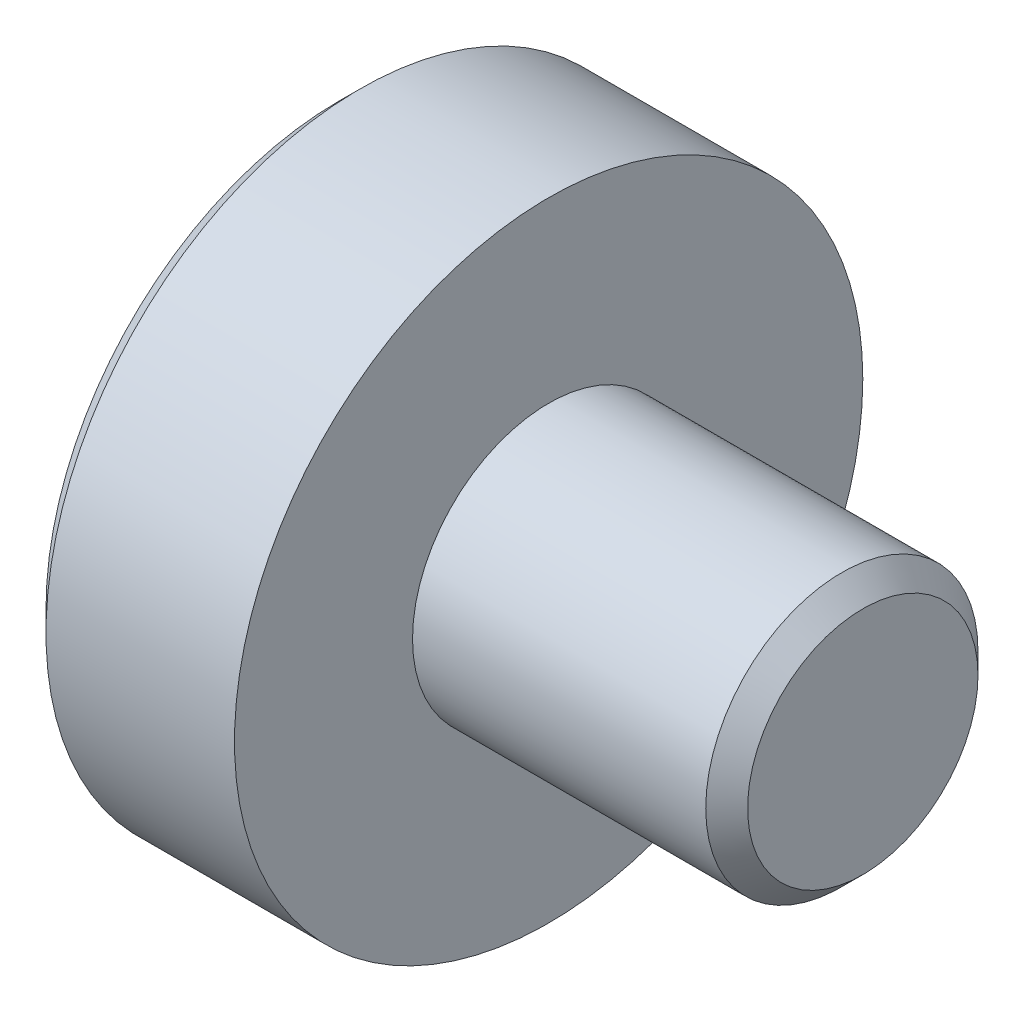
SolidWorks part; units mm, degrees
ref_plane "Front Plane" through (0, 0, 0) normal (0, 0, 1) x (1, 0, 0)
ref_plane "Top Plane" through (0, 0, 0) normal (0, 1, 0) x (1, 0, 0)
ref_plane "Right Plane" through (0, 0, 0) normal (1, 0, 0) x (0, 0, -1)
sketch "Sketch1" plane through (0, 0, 0) normal (1, 0, 0) x (0, 0, -1)
  circle A0 centre (0, 0) radius 15
  dimension "D1" = 30
extrude "Boss-Extrude1" add sketch "Sketch1" along normal blind 10
sketch "Sketch2" plane through (10, 0, 0) normal (1, 0, 0) x (0, 0, -1)
  circle A0 centre (0, 0) radius 6.5
  dimension "D1" = 13
extrude "Boss-Extrude2" add sketch "Sketch2" along normal blind 15
chamfer "Chamfer1" distance 1 angle 45 2 edges at (25, 0, -6.5) (0, 0, -15)
